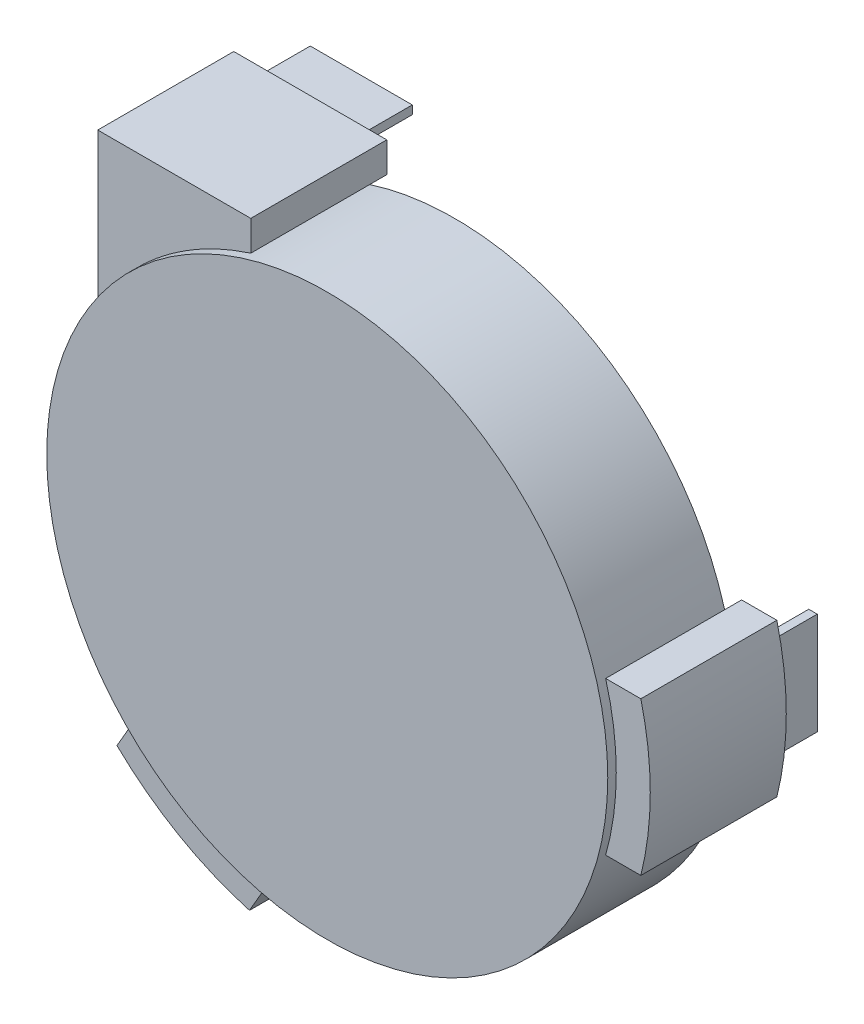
SolidWorks part; units mm, degrees
ref_plane "Plan de face" through (0, 0, 0) normal (0, 0, 1) x (1, 0, 0)
ref_plane "Plan de dessus" through (0, 0, 0) normal (0, 1, 0) x (1, 0, 0)
ref_plane "Plan de droite" through (0, 0, 0) normal (1, 0, 0) x (0, 0, -1)
sketch "Esquisse1" plane through (0, 0, 0) normal (0, 0, 1) x (1, 0, 0)
  circle A0 centre (0, 0) radius 16.5
extrude "Extrusion1" add sketch "Esquisse1" along normal blind 7.5
ref_plane "Plan1" through (0, 0, 7) normal (0, 0, 1) x (1, 0, 0)
sketch "Esquisse2" plane through (0, 0, 7) normal (0, 0, 1) x (1, 0, 0)
  line L0 (15.8745, -4.5) -> (17.9444, -4.5)
  line L1 (15.8745, 4.5) -> (17.9444, 4.5)
  line L2 (15.8745, -4.5) -> (17.9444, -4.5)
  line L3 (15.8745, 4.5) -> (17.9444, 4.5)
  line L4 (-11.8344, -11.4977) -> (-12.8693, -13.2903)
  line L5 (-4.0401, -15.9977) -> (-5.0751, -17.7903)
  line L6 (-5, 15.7242) -> (-5, 17.5)
  line L7 (-14, 17.5) -> (-14, 8.7321)
  line L8 (-14, 17.5) -> (-5, 17.5)
  arc A0 (17.9444, -4.5) -> (17.9444, 4.5) centre (0, 0) ccw
  arc A2 (17.9444, -4.5) -> (17.9444, 4.5) centre (0, 0) ccw
  arc A3 (15.8745, -4.5) -> (15.8745, 4.5) centre (0, 0) ccw
  arc A4 (-12.8693, -13.2903) -> (-5.0751, -17.7903) centre (0, 0) ccw
  arc A5 (-11.8344, -11.4977) -> (-4.0401, -15.9977) centre (0, 0) ccw
  arc A8 (-5, 15.7242) -> (-14, 8.7321) centre (0, 0) ccw
  dimension "D1" = 9
  dimension "D2" = 17.5
extrude "Extrusion2" add sketch "Esquisse2" against normal blind 8 separate body contours A8 L7 L8 L6 | A3 L3 A2 L0 | A5 L5 A4 L4
sketch "Esquisse3" plane through (0, 0, -1) normal (0, 0, -1) x (-1, 0, 0)
  line L0 (-17.3216, 3) -> (-17.3216, -3)
  line L1 (-17.3216, 3) -> (-16.8216, 3)
  line L2 (-17.3216, -3) -> (-16.8216, -3)
  line L3 (-16.8216, 3) -> (-16.8216, -3)
  line L4 (-17.3216, 3) -> (-17.3216, -3)
  line L5 (-17.3216, -3) -> (-16.8216, -3)
  line L6 (-17.3216, 3) -> (-16.8216, 3)
  line L7 (-16.8216, 3) -> (-16.8216, -3)
  line L8 (6.0627, -16.501) -> (11.2589, -13.501)
  line L9 (11.2589, -13.501) -> (11.0089, -13.068)
  line L10 (6.0627, -16.501) -> (5.8127, -16.068)
  line L11 (5.8127, -16.068) -> (11.0089, -13.068)
  line L14 (6.5, 17.0297) -> (6.5, 16.5297)
  line L15 (12.5, 17.0297) -> (12.5, 16.5297)
  line L16 (6.5, 17.0297) -> (12.5, 17.0297)
  line L17 (6.5, 16.5297) -> (12.5, 16.5297)
  dimension "D3" = 0.5
extrude "Extrusion3" add sketch "Esquisse3" along normal blind 3 contours L16 L15 L17 L14 | L8 L9 L11 L10 | L0 L5 L7 L6
